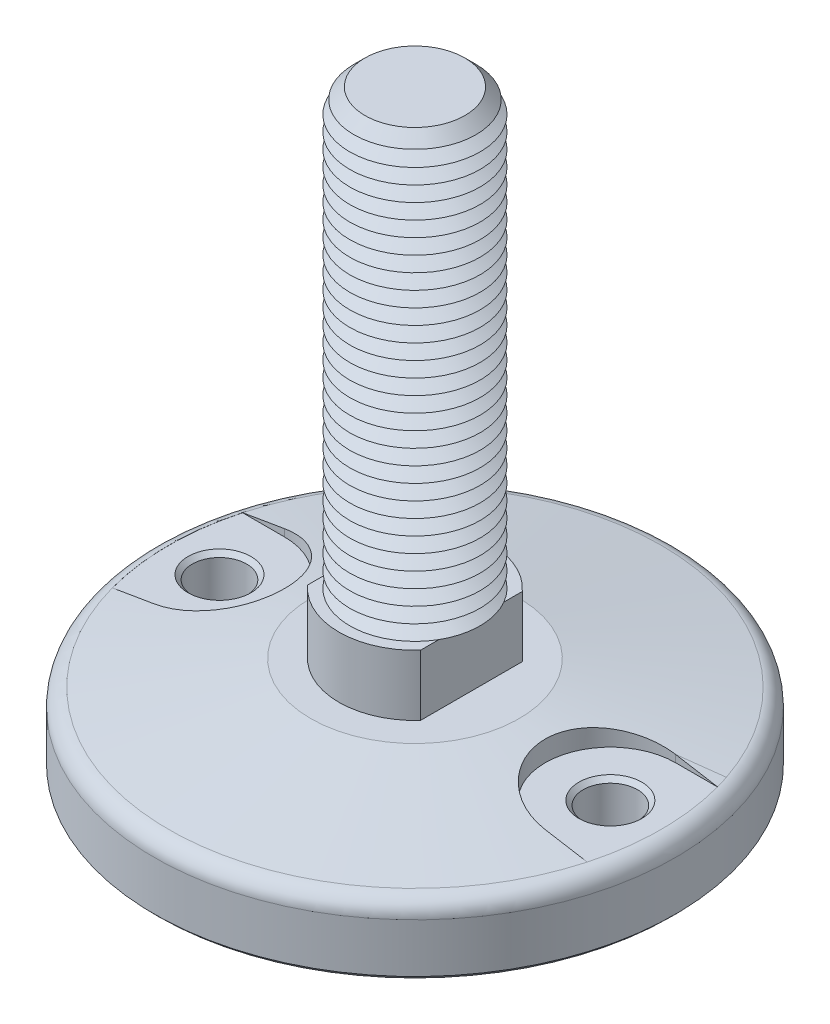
SolidWorks part; units mm, degrees
ref_plane "Front Plane" through (0, 0, 0) normal (0, 0, 1) x (1, 0, 0)
ref_plane "Top Plane" through (0, 0, 0) normal (0, 1, 0) x (1, 0, 0)
ref_plane "Right Plane" through (0, 0, 0) normal (1, 0, 0) x (0, 0, -1)
sketch "Sketch1" plane through (0, 0, 0) normal (1, 0, 0) x (0, 0, -1)
  line L0 (0, 61.3389) -> (0, -58.404) construction
sketch "Sketch2" plane through (0, 0, 0) normal (1, 0, 0) x (0, 0, -1)
  line L0 (0, 0) -> (-24, 0)
  line L1 (-24, 0) -> (-60, -6.3478)
  line L2 (-60, -6.3478) -> (-60, -22)
  line L3 (-60, -22) -> (0, -22)
  line L4 (0, 61.3389) -> (0, -58.404) construction
  line L5 (0, -22) -> (0, 0)
  dimension "D1" = 22
  dimension "D2" = 60
  dimension "D3" = 24
  dimension "D4" = 10
revolve "Revolve1" add sketch "Sketch2" angle 360 about L0
fillet "Fillet1" radius 4 1 edges at (0, -6.3478, 60)
sketch "Sketch3" plane through (0, 0, 0) normal (0, 1, 0) x (1, 0, 0)
  circle A0 centre (0, 0) radius 17.5
  dimension "D1" = 35
extrude "Boss-Extrude1" add sketch "Sketch3" along normal blind 14
sketch "Sketch4" plane through (0, 14, 0) normal (0, 1, 0) x (1, 0, 0)
  line L0 (-13, 11.7154) -> (-13, -11.7154)
  line L2 (13, -11.7154) -> (13, 11.7154)
  arc A0 (-13, 11.7154) -> (-13, -11.7154) centre (0, 0) ccw
  circle A1 centre (0, 0) radius 17.5 construction
  arc A2 (13, -11.7154) -> (13, 11.7154) centre (0, 0) ccw
  dimension "D1" = 26
extrude "Cut-Extrude1" cut sketch "Sketch4" against normal blind 14
sketch "Sketch5" plane through (0, 14, 0) normal (0, 1, 0) x (1, 0, 0)
  circle A0 centre (0, 0) radius 15
  dimension "D1" = 30
extrude "Boss-Extrude2" add sketch "Sketch5" along normal blind 100
chamfer "Chamfer1" distance 3.5 angle 45 1 edges at (0, 114, 15)
sketch "Sketch6" plane through (0, 0, 0) normal (1, 0, 0) x (0, 0, -1)
  line L0 (-15, 14) -> (-11.9689, 15.75)
  line L1 (-11.9689, 15.75) -> (-15, 17.5)
  line L2 (-15, 110.5) -> (-15, 14) construction
  line L3 (-15, 17.5) -> (-15, 14)
  dimension "D1" = 3.5
revolve "Cut-Revolve1" cut sketch "Sketch6" angle 360 about L0
pattern_linear "LPattern1" count 28 spacing 3.5 along (0, 1, 0) of "Cut-Revolve1"
sketch "Sketch8" plane through (0, 0, 0) normal (0, 1, 0) x (1, 0, 0)
  line L0 (-45, 15) -> (-54.6743, 15)
  line L1 (-45, -15) -> (-54.6743, -15)
  arc A1 (-54.6743, 15) -> (-54.6743, -15) centre (0, 0) ccw
  circle A2 centre (0, 0) radius 56.6946 construction
  arc A3 (-45, -15) -> (-45, 15) centre (-45, 0) ccw
  point P3 (-45, 0)
  point P11 (0, 0)
  dimension "D1" = 45
  dimension "D2" = 30
extrude "Cut-Extrude4" cut sketch "Sketch8" against normal blind 5.79
sketch "Sketch10" plane through (0, -5.79, 0) normal (0, 1, 0) x (1, 0, 0)
  circle A0 centre (-45, 0) radius 6.25
  dimension "D1" = 12.5
extrude "Cut-Extrude5" cut sketch "Sketch10" against normal up to surface (16.21 mm away)
chamfer "Chamfer2" distance 1 angle 45 2 edges at (-45, -22, -6.25) (-45, -5.79, 6.25)
mirror "Mirror1" about plane through (0, 0, 0) normal (1, 0, 0) of "Chamfer2", "Cut-Extrude5", "Cut-Extrude4"
chamfer "Chamfer3" distance 1 angle 45 1 edges at (0, -22, 60)
